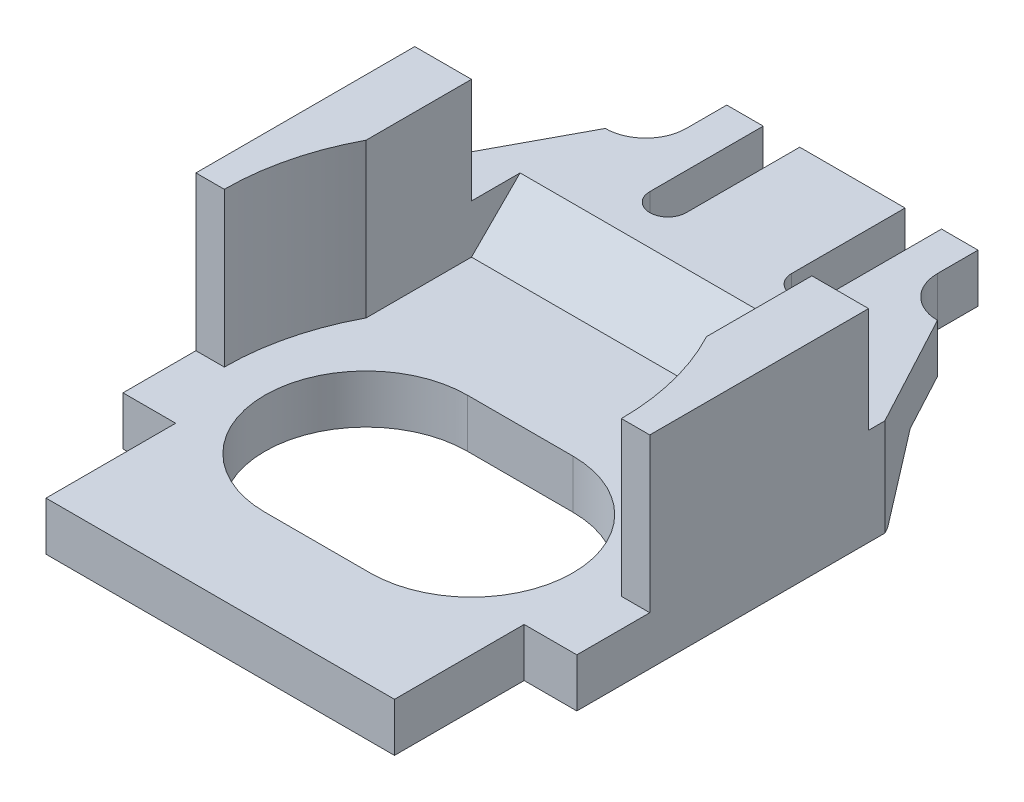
SolidWorks part; units mm, degrees
ref_plane "Front" through (0, 0, 0) normal (0, 0, 1) x (1, 0, 0)
ref_plane "Top" through (0, 0, 0) normal (0, 1, 0) x (1, 0, 0)
ref_plane "Right" through (0, 0, 0) normal (1, 0, 0) x (0, 0, -1)
sketch "Sketch1" plane through (0, 0, 0) normal (0, 1, 0) x (1, 0, 0)
  line L0 (0, 0) -> (0, 85.7881) construction
  line L1 (-6.5, 0) -> (6.5, 0) construction
  line L2 (-6.5, 12.5) -> (6.5, 12.5)
  line L3 (-6.5, -12.5) -> (6.5, -12.5)
  line L4 (-28, -8.5) -> (-21.5, -8.5)
  line L5 (28, -8.5) -> (21.5, -8.5)
  line L6 (-21.5, -8.5) -> (-21.5, -24.5)
  line L7 (21.5, -8.5) -> (21.5, -24.5)
  line L8 (-21.5, -24.5) -> (21.5, -24.5)
  line L9 (-28, -8.5) -> (-28, 29.5)
  line L10 (28, -8.5) -> (28, 29.5)
  line L11 (-28, 29.5) -> (-20.5, 43.5)
  line L12 (28, 29.5) -> (20.5, 43.5)
  line L13 (-20.5, 43.5) -> (-15.5, 43.5)
  line L14 (20.5, 43.5) -> (15.5, 43.5)
  line L15 (-15.5, 43.5) -> (-15.5, 53.5)
  line L16 (15.5, 43.5) -> (15.5, 53.5)
  line L17 (-15.5, 53.5) -> (-11, 53.5)
  line L18 (-6.5, 53.5) -> (-6.5, 39.5)
  line L20 (6.5, 53.5) -> (6.5, 39.5)
  line L21 (11, 53.5) -> (15.5, 53.5)
  line L22 (11, 53.5) -> (11, 39.5)
  line L24 (-11, 53.5) -> (-11, 39.5)
  line L26 (6.5, 53.5) -> (-6.5, 53.5)
  arc A0 (6.5, 12.5) -> (6.5, -12.5) centre (6.5, 0) cw
  arc A1 (-6.5, 12.5) -> (-6.5, -12.5) centre (-6.5, 0) ccw
  arc A2 (6.5, 39.5) -> (11, 39.5) centre (8.75, 39.5) ccw
  arc A3 (-6.5, 39.5) -> (-11, 39.5) centre (-8.75, 39.5) cw
  point P8 (0, 12.5)
  point P18 (0, -24.5)
  point P27 (0, 104.018)
  dimension "D1" = 25
  dimension "D2" = 38
  dimension "D11" = 14
  dimension "D3" = 43
  dimension "D4" = 16
  dimension "D5" = 37
  dimension "D6" = 38
  dimension "D7" = 56
  dimension "D8" = 31
  dimension "D9" = 4.5
  dimension "D10" = 13
  dimension "D12" = 10
  dimension "D13" = 14
  dimension "D14" = 5
extrude "Base-Extrude" add sketch "Sketch1" along normal mid plane 12
sketch "Sketch2" plane through (0, 0, 0) normal (1, 0, 0) x (0, 0, -1)
  line L1 (-24.5, 6) -> (27.5, 6)
  line L2 (-24.5, 6) -> (-24.5, 0)
  line L3 (-24.5, 0) -> (27.5, 0)
  line L4 (29.5, 6) -> (43.5, 6) construction
  line L5 (27.5, 6) -> (27.5, 0)
  line L6 (29.5, 6) -> (29.5, -6) construction
  line L7 (36.25, 0) -> (30.25, -6)
  line L8 (53.5, -6) -> (30.25, -6)
  line L9 (53.5, -6) -> (53.5, 0)
  line L10 (53.5, 0) -> (36.25, 0)
  line L12 (37.25, 6) -> (37.25, -6) construction
  dimension "D1" = 6
  dimension "D2" = 2
  dimension "D3" = 1
  dimension "D5" = 45
extrude "Cut-Extrude1" cut sketch "Sketch2" against normal through all and the other way through all
sketch "Sketch3" plane through (0, 0, 0) normal (0, 1, 0) x (-1, 0, 0)
  line L0 (-28, 8.5) -> (-28, -27.5) construction
  line L1 (28, -27.5) -> (-28, -27.5) construction
  line L2 (-28, -0.5) -> (-28, -27.5)
  line L3 (-21, -27.5) -> (-28, -27.5)
  line L4 (-28, -0.5) -> (-24.5, -0.5)
  line L5 (-21, -14.5) -> (-21, -27.5)
  arc A0 (-21, -14.5) -> (-24.5, -0.5) centre (5.25, -0.5) cw
  dimension "D1" = 27
  dimension "D2" = 7
  dimension "D3" = 3.5
  dimension "D4" = 13
extrude "Boss-Extrude1" add sketch "Sketch3" along normal blind 19
mirror "Mirror1" about plane through (0, 0, 0) normal (1, 0, 0)
chamfer "Chamfer1" distance 6 angle 45
fillet "Fillet1" radius 5
